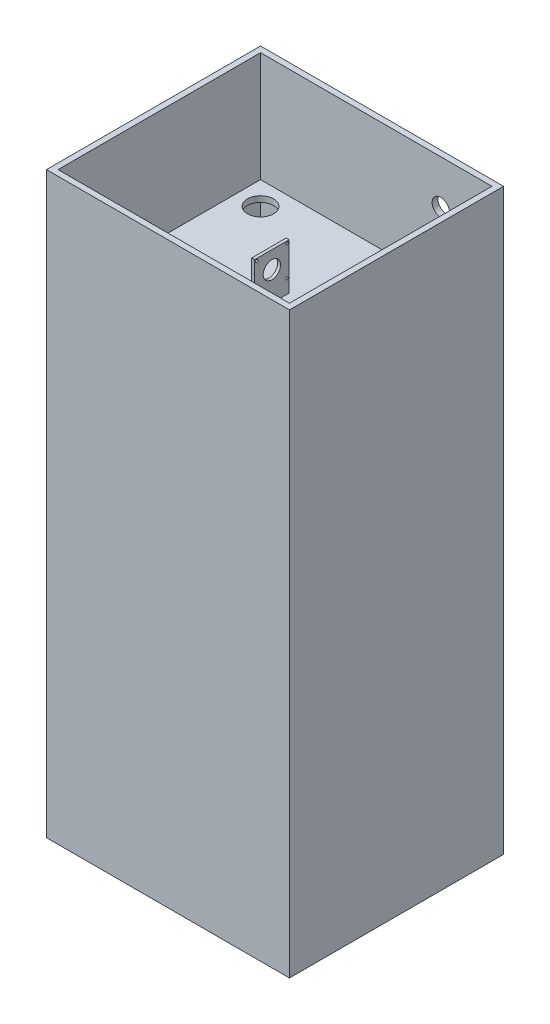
SolidWorks part; units mm, degrees
other "barrier cap"
other "barrier body"
ref_plane "Front Plane" through (0, 0, 0) normal (0, 0, 1) x (1, 0, 0)
ref_plane "Top Plane" through (0, 0, 0) normal (0, 1, 0) x (1, 0, 0)
ref_plane "Right Plane" through (0, 0, 0) normal (1, 0, 0) x (0, 0, -1)
sketch "Sketch1" plane through (0, 0, 0) normal (0, 1, 0) x (1, 0, 0)
  line L1 (-200, -175) -> (200, -175)
  line L2 (-200, -175) -> (-200, 175)
  line L3 (-200, 175) -> (200, 175)
  line L4 (200, -175) -> (200, 175)
  line L5 (-200, -175) -> (200, 175) construction
  line L6 (-200, 175) -> (200, -175) construction
  point P0 (0, 0)
  dimension "D1" = 400
  dimension "D2" = 350
extrude "Extrude-Thin1" add sketch "Sketch1" along normal blind 1000 thin
ref_plane "Plane1" through (0, 800, 0) normal (0, 1, 0) x (1, 0, 0)
sketch "Sketch2" plane through (0, 800, 0) normal (0, 1, 0) x (1, 0, 0)
  line L0 (-200, -175) -> (200, -175) construction
  line L1 (200, -175) -> (200, 175) construction
  line L2 (200, 175) -> (-200, 175) construction
  line L3 (-200, 175) -> (-200, -175) construction
  line L4 (-200, -175) -> (200, -175)
  line L5 (200, -175) -> (200, 175)
  line L6 (200, 175) -> (-200, 175)
  line L7 (-200, 175) -> (-200, -175)
extrude "Boss-Extrude1" add sketch "Sketch2" along normal blind 10
sketch "Sketch3" plane through (0, 810, 0) normal (0, 1, 0) x (1, 0, 0)
  line L0 (200, 175) -> (-200, 175) construction
  line L1 (-200, 175) -> (-200, -175) construction
  circle A0 centre (-160, 135) radius 22.5
  dimension "D1" = 45
  dimension "D3" = 45
  dimension "D2" = 40
  dimension "D4" = 40
extrude "Cut-Extrude1" cut sketch "Sketch3" against normal blind 20
sketch "Sketch12" plane through (0, 1000, 0) normal (0, 1, 0) x (1, 0, 0)
  line L0 (210, -185) -> (210, 185) construction
  line L1 (-210, -185) -> (210, -185) construction
  line L2 (-210, 185) -> (-210, -185) construction
  line L3 (210, 185) -> (-210, 185) construction
  line L4 (210, -185) -> (210, 185)
  line L5 (210, 185) -> (-210, 185)
  line L6 (-210, 185) -> (-210, -185)
  line L7 (-210, -185) -> (210, -185)
  line L8 (210, -185) -> (210, 185)
  line L9 (210, 185) -> (-210, 185)
  line L10 (-210, 185) -> (-210, -185)
  line L11 (-210, -185) -> (210, -185)
  line L12 (210, -185) -> (210, 185)
  line L13 (-210, -185) -> (210, -185)
  line L14 (-210, 185) -> (-210, -185)
  line L15 (210, 185) -> (-210, 185)
  dimension "D1" = 0
extrude "Extrude-Thin4" add sketch "Sketch12" along normal blind 70 separate body thin
move or copy body "Body-Move/Copy1" bodies to move or copy 107 copy no translate (902.9364, 0, 0)
other "Save Bodies1"
sketch "Sketch13" plane through (210, 0, 0) normal (1, 0, 0) x (0, 0, -1)
  line L0 (-185, 0) -> (185, 0) construction
  line L1 (-150, 150) -> (150, 150)
  line L2 (-150, 150) -> (-150, 650)
  line L3 (-150, 650) -> (150, 650)
  line L4 (150, 150) -> (150, 650)
  line L5 (-150, 150) -> (150, 650) construction
  line L6 (-150, 650) -> (150, 150) construction
  line L7 (185, 1000) -> (185, 0) construction
  line L8 (-185, 1000) -> (-185, 0) construction
  point P0 (0, 400)
  point P7 (150, 400)
  dimension "D1" = 500
  dimension "D2" = 300
  dimension "D3" = 150
  dimension "D4" = 35
  dimension "D5" = 370
extrude "Cut-Extrude3" cut sketch "Sketch13" against normal blind 10
sketch "Sketch15" plane through (-210, 0, 0) normal (-1, 0, 0) x (0, 0, 1)
  line L0 (-150, 150) -> (-150, 650) construction
  line L1 (150, 150) -> (-150, 150) construction
  line L2 (150, 650) -> (150, 150) construction
  line L3 (-150, 650) -> (150, 650) construction
  line L12 (-150, 150) -> (-150, 650)
  line L13 (150, 150) -> (-150, 150)
  line L14 (150, 650) -> (150, 150)
  line L15 (-150, 650) -> (150, 650)
extrude "Cut-Extrude6" cut sketch "Sketch15" against normal blind 10
sketch "Sketch18" plane through (210, 0, 0) normal (1, 0, 0) x (0, 0, -1)
  line L0 (-150, 650) -> (-150, 150) construction
  line L1 (-150, 150) -> (150, 150) construction
  line L2 (150, 150) -> (150, 650) construction
  line L3 (150, 650) -> (-150, 650) construction
  line L12 (-150, 650) -> (-150, 150)
  line L13 (-150, 150) -> (150, 150)
  line L14 (150, 150) -> (150, 650)
  line L15 (150, 650) -> (-150, 650)
extrude "Boss-Extrude2" add sketch "Sketch18" against normal blind 10
sketch "Sketch19" plane through (0, 810, 0) normal (0, 1, 0) x (1, 0, 0)
  line L0 (-10.4075, 175) -> (-10.4075, -175) construction
  line L1 (200, 175) -> (-200, 175) construction
  line L2 (-200, -175) -> (200, -175) construction
  line L3 (-10.4075, 30) -> (-185.4075, 30) construction
  line L4 (-185.4075, 30) -> (-185.4075, -30) construction
  line L5 (-185.4075, -30) -> (-10.4075, -30) construction
  line L6 (200, 0) -> (-223.9634, 0) construction
  line L7 (200, -175) -> (200, 175) construction
  line L9 (-10.4075, 30) -> (-5.4075, 30)
  line L10 (-10.4075, 30) -> (-10.4075, -30)
  line L11 (-10.4075, -30) -> (-5.4075, -30)
  line L12 (-5.4075, 30) -> (-5.4075, -30)
  dimension "D1" = 30
  dimension "D2" = 30
  dimension "D3" = 175
  dimension "D4" = 5
extrude "Boss-Extrude3" add sketch "Sketch19" along normal blind 80
sketch "Sketch20" plane through (-10.4075, 0, 0) normal (-1, 0, 0) x (0, 0, 1)
  line L0 (-30, 890) -> (-30, 810) construction
  line L1 (-30, 890) -> (30, 890) construction
  line L2 (30, 890) -> (30, 810) construction
  line L3 (-30, 810) -> (30, 810) construction
  point P0 (-26, 886)
  point P1 (26, 886)
  point P2 (-26, 834)
  point P3 (26, 834)
  dimension "D1" = 4
  dimension "D2" = 4
  dimension "D3" = 4
  dimension "D4" = 4
  dimension "D5" = 4
  dimension "D6" = 4
  dimension "D7" = 24
  dimension "D8" = 24
  dimension "D9" = 4
hole_wizard "Ø4.0mm Dowel Slot1" positions "Sketch21" profile "Sketch22" size "Ø4.0" standard "ISO"
sketch "Sketch21" plane through (-10.4075, 0, 0) normal (-1, 0, 0) x (0, 0, 1)
  point P0 (-26, 834)
  point P3 (-26, 886)
  point P6 (26, 886)
  point P9 (26, 834)
sketch "Sketch22" plane through (-10.4075, 834, -26) normal (0, 1, 0) x (0, 0, 1)
  line L0 (0, 0) -> (0, 21.2017)
  line L1 (0, 21.2017) -> (2, 20)
  line L2 (2, 20) -> (2, 0)
  line L5 (2, 0) -> (0, 0)
  line L10 (0, 21.2017) -> (-2, 20) construction
  line L11 (0, -6.35) -> (0, 107.95) construction
  dimension "Hole Dia." = 4
  dimension "Hole Depth" = 20
  dimension "Drill Angle" = 118
sketch "Sketch24" plane through (0, 810, 0) normal (0, 1, 0) x (1, 0, 0)
  line L0 (-10.4075, 30) -> (-200, 30) construction
  line L1 (-200, 175) -> (-200, -175) construction
  dimension "D1" = 189.5925
sketch "Sketch26" plane through (-5.4075, 0, 0) normal (1, 0, 0) x (0, 0, -1)
  line L0 (-30, 890) -> (30, 890) construction
  line L1 (30, 890) -> (30, 810) construction
  circle A0 centre (0, 860) radius 15
  dimension "D3" = 30
  dimension "D1" = 30
  dimension "D2" = 30
extrude "Cut-Extrude7" cut sketch "Sketch26" against normal blind 10
sketch "Sketch27" plane through (0, 0, -185) normal (0, 0, -1) x (-1, 0, 0)
  line L0 (-210, 1000) -> (-210, 0) construction
  line L1 (-210, 0) -> (210, 0) construction
  circle A0 centre (-111.59, 924.18) radius 15
  point P0 (-111.59, 924.18)
  dimension "D3" = 30
  dimension "D1" = 98.41
  dimension "D2" = 924.18
extrude "Cut-Extrude8" cut sketch "Sketch27" against normal blind 10
